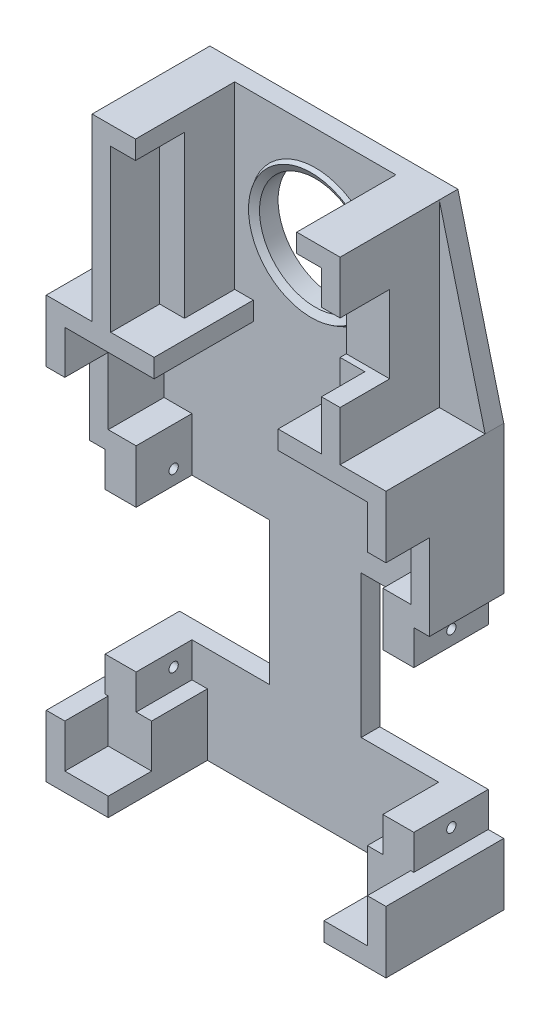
SolidWorks part; units mm, degrees
ref_plane "Plan de face" through (0, 0, 0) normal (0, 0, 1) x (1, 0, 0)
ref_plane "Plan de dessus" through (0, 0, 0) normal (0, 1, 0) x (1, 0, 0)
ref_plane "Plan de droite" through (0, 0, 0) normal (1, 0, 0) x (0, 0, -1)
sketch "Esquisse1" plane through (0, 0, 0) normal (0, 0, 1) x (1, 0, 0)
  line L0 (-27.4, 0) -> (27.4, 0)
  line L1 (27.4, 0) -> (27.4, 10)
  line L2 (27.4, 10) -> (24.9, 10)
  line L3 (24.9, 10) -> (24.9, 15.6)
  line L4 (24.9, 15.6) -> (7.4, 15.6)
  line L5 (7.4, 15.6) -> (7.4, 38.6)
  line L6 (7.4, 38.6) -> (24.9, 38.6)
  line L7 (24.9, 38.6) -> (24.9, 44.2)
  line L8 (24.9, 44.2) -> (27.4, 44.2)
  line L9 (27.4, 44.2) -> (27.4, 68)
  line L10 (27.4, 68) -> (20, 97)
  line L11 (20, 97) -> (-20, 97)
  line L12 (-20, 97) -> (-27.4, 68)
  line L13 (-27.4, 68) -> (-27.4, 44.2)
  line L14 (-27.4, 44.2) -> (-24.9, 44.2)
  line L15 (-24.9, 44.2) -> (-24.9, 38.6)
  line L16 (-24.9, 38.6) -> (-7.4, 38.6)
  line L17 (-7.4, 38.6) -> (-7.4, 15.6)
  line L18 (-7.4, 15.6) -> (-24.9, 15.6)
  line L19 (-24.9, 15.6) -> (-24.9, 10)
  line L20 (-24.9, 10) -> (-27.4, 10)
  line L21 (-27.4, 10) -> (-27.4, 0)
  circle A0 centre (0, 81) radius 9
  dimension "D24" = 18
  dimension "D1" = 97
  dimension "D2" = 23
  dimension "D3" = 23
  dimension "D4" = 17.5
  dimension "D5" = 17.5
  dimension "D6" = 27.4
  dimension "D7" = 27.4
  dimension "D8" = 10
  dimension "D9" = 10
  dimension "D10" = 5.6
  dimension "D11" = 5.6
  dimension "D12" = 5.6
  dimension "D13" = 5.6
  dimension "D14" = 2.5
  dimension "D15" = 2.5
  dimension "D16" = 2.5
  dimension "D17" = 2.5
  dimension "D18" = 17.5
  dimension "D19" = 17.5
  dimension "D20" = 68
  dimension "D21" = 68
  dimension "D22" = 7.4
  dimension "D23" = 7.4
  dimension "D25" = 16
extrude "Boss.-Extru.1" add sketch "Esquisse1" along normal blind 3
sketch "Esquisse2" plane through (0, 0, 3) normal (0, 0, 1) x (1, 0, 0)
  line L0 (27.4, 0) -> (27.4, 10) construction
  line L1 (-27.4, 68) -> (-20, 68)
  line L2 (-27.4, 68) -> (-27.4, 44.2)
  line L3 (-24.4, 58) -> (-17.4, 58)
  line L4 (-17.4, 65) -> (-17.4, 58)
  line L5 (27.4, 68) -> (20, 68)
  line L6 (27.4, 68) -> (27.4, 44.2)
  line L7 (24.4, 58) -> (17.4, 58)
  line L8 (17.4, 65) -> (17.4, 58)
  line L9 (-27.4, 0) -> (-17.4, 0)
  line L10 (-27.4, 0) -> (-27.4, 10)
  line L11 (-27.4, 10) -> (-24.9, 10)
  line L12 (-17.4, 0) -> (-17.4, 10)
  line L13 (27.4, 0) -> (17.4, 0)
  line L14 (27.4, 0) -> (27.4, 10)
  line L15 (27.4, 10) -> (24.9, 10)
  line L16 (17.4, 0) -> (17.4, 10)
  line L17 (-27.4, 0) -> (27.4, 0) construction
  line L18 (24.9, 15.6) -> (7.4, 15.6) construction
  line L19 (-24.9, 15.6) -> (-19.9, 15.6)
  line L20 (-24.9, 15.6) -> (-24.9, 10)
  line L22 (-19.9, 15.6) -> (-19.9, 10)
  line L23 (24.9, 15.6) -> (19.9, 15.6)
  line L24 (24.9, 15.6) -> (24.9, 10)
  line L26 (19.9, 15.6) -> (19.9, 10)
  line L27 (-19.9, 10) -> (-17.4, 10)
  line L28 (19.9, 10) -> (17.4, 10)
  line L29 (20, 97) -> (-20, 97) construction
  line L30 (-24.9, 38.6) -> (-19.9, 38.6)
  line L31 (-24.9, 38.6) -> (-24.9, 44.2)
  line L33 (-19.9, 38.6) -> (-19.9, 47.2)
  line L34 (24.9, 38.6) -> (19.9, 38.6)
  line L35 (24.9, 38.6) -> (24.9, 44.2)
  line L36 (24.4, 47.2) -> (19.9, 47.2)
  line L37 (19.9, 38.6) -> (19.9, 47.2)
  line L38 (-17.4, 65) -> (-13, 65)
  line L39 (-20, 68) -> (-20, 97)
  line L40 (-20, 97) -> (-13, 97)
  line L41 (-13, 65) -> (-13, 97)
  line L42 (-20, 97) -> (-27.4, 68) construction
  line L43 (17.4, 65) -> (13, 65)
  line L44 (20, 68) -> (20, 97)
  line L45 (20, 97) -> (13, 97)
  line L46 (13, 65) -> (13, 97)
  line L47 (27.4, 68) -> (20, 97) construction
  line L49 (-24.4, 58) -> (-24.4, 47.2)
  line L50 (-24.9, 44.2) -> (-27.4, 44.2)
  line L51 (-24.4, 47.2) -> (-19.9, 47.2)
  line L52 (24.4, 58) -> (24.4, 47.2)
  line L53 (24.9, 44.2) -> (27.4, 44.2) construction
  line L54 (-27.4, 68) -> (-27.4, 44.2) construction
  line L55 (24.9, 44.2) -> (27.4, 44.2)
  point P2 (27.4, 44.8457)
  point P7 (23.7, 68)
  dimension "D1" = 10
  dimension "D2" = 10
  dimension "D3" = 10
  dimension "D4" = 10
  dimension "D5" = 3
  dimension "D6" = 3
  dimension "D7" = 3
  dimension "D8" = 10
  dimension "D9" = 5
  dimension "D10" = 5
  dimension "D11" = 5
  dimension "D12" = 5
  dimension "D13" = 7
  dimension "D14" = 7
  dimension "D15" = 10
  dimension "D16" = 3
  dimension "D17" = 3
  dimension "D18" = 3
  dimension "D19" = 10
  dimension "D20" = 10
extrude "Boss.-Extru.2" add sketch "Esquisse2" along normal blind 9
sketch "Esquisse3" plane through (0, 0, 3) normal (0, 0, 1) x (1, 0, 0)
  line L0 (-27.4, 0) -> (-27.4, 10)
  line L1 (-27.4, 10) -> (-24.4, 10)
  line L2 (-24.4, 10) -> (-24.4, 3)
  line L3 (-24.4, 3) -> (-17.4, 3)
  line L4 (-17.4, 0) -> (-17.4, 10) construction
  line L5 (-17.4, 3) -> (-17.4, 0)
  line L6 (-27.4, 0) -> (-17.4, 0) construction
  line L7 (-17.4, 0) -> (-27.4, 0)
  line L8 (27.4, 0) -> (27.4, 10)
  line L9 (27.4, 10) -> (24.4, 10)
  line L10 (24.4, 10) -> (24.4, 3)
  line L11 (24.4, 3) -> (17.4, 3)
  line L12 (17.4, 10) -> (17.4, 0) construction
  line L13 (17.4, 3) -> (17.4, 0)
  line L14 (17.4, 0) -> (27.4, 0)
  line L15 (-27.4, 68) -> (-20, 68)
  line L16 (-20, 68) -> (-20, 97)
  line L18 (20, 88.5) -> (20, 97)
  line L19 (-17, 94) -> (-17, 68)
  line L20 (-17, 68) -> (-10, 68)
  line L21 (17, 88.5) -> (20, 88.5)
  line L22 (-10, 68) -> (-10, 65)
  line L23 (-10, 65) -> (-24.4, 65)
  line L24 (-24.4, 65) -> (-24.4, 58)
  line L25 (-24.4, 58) -> (-17.4, 58) construction
  line L26 (-24.4, 58) -> (-27.4, 58)
  line L27 (-27.4, 58) -> (-27.4, 44.2) construction
  line L28 (-27.4, 58) -> (-27.4, 68)
  line L29 (24.4, 58) -> (27.4, 58)
  line L30 (17.4, 58) -> (24.4, 58) construction
  line L31 (27.4, 58) -> (27.4, 68)
  line L32 (27.4, 68) -> (20, 68)
  line L33 (20, 68) -> (20, 97) construction
  line L34 (20, 68) -> (20, 97) construction
  line L35 (20, 68) -> (20, 76)
  line L38 (17, 94) -> (17, 88.5)
  line L39 (17, 68) -> (10, 68)
  line L40 (10, 68) -> (10, 65)
  line L41 (10, 65) -> (24.4, 65)
  line L42 (24.4, 65) -> (24.4, 58)
  line L44 (17, 76) -> (20, 76)
  line L46 (17, 76) -> (17, 68)
  line L47 (-20, 97) -> (-13, 97)
  line L48 (-13, 97) -> (-13, 94)
  line L49 (-13, 65) -> (-13, 97) construction
  line L50 (-13, 94) -> (-17, 94)
  line L51 (20, 97) -> (13, 97)
  line L52 (13, 97) -> (13, 94)
  line L53 (13, 97) -> (13, 65) construction
  line L54 (13, 94) -> (17, 94)
  dimension "D1" = 3
  dimension "D2" = 3
  dimension "D3" = 3
  dimension "D4" = 3
  dimension "D5" = 3
  dimension "D6" = 3
  dimension "D7" = 3
  dimension "D8" = 3
  dimension "D9" = 3
  dimension "D10" = 3
  dimension "D11" = 3
  dimension "D12" = 3
  dimension "D13" = 5.5
  dimension "D14" = 8
  dimension "D15" = 3
  dimension "D16" = 3
  dimension "D17" = 7
  dimension "D18" = 7
extrude "Boss.-Extru.3" add sketch "Esquisse3" along normal blind 16
sketch "Esquisse4" plane through (0, 0, 0) normal (1, 0, 0) x (0, 0, -1)
  line L0 (-3, 72) -> (-3.6495, 70.875)
  line L1 (-3.6495, 70.875) -> (-3, 70.5)
  line L2 (-3, 68) -> (-3, 97) construction
  line L3 (-3, 70.5) -> (-3, 72)
  line L4 (-8.5738, 81) -> (12.7557, 81) construction
  dimension "D1" = 30
  dimension "D2" = 1.5
  dimension "D3" = 9
revolve "Révolution1" add sketch "Esquisse4" angle 360 about L4
sketch "Esquisse5" plane through (0, 0, 0) normal (1, 0, 0) x (0, 0, -1)
  line L0 (0, 10) -> (0, 15.6) construction
  line L1 (0, 38.6) -> (0, 44.2) construction
  line L2 (-12, 38.6) -> (0, 38.6) construction
  line L3 (-12, 15.6) -> (0, 15.6) construction
  circle A0 centre (-5.95, 40.95) radius 0.75
  circle A1 centre (-5.95, 13.25) radius 0.75
  dimension "D5" = 1.5
  dimension "D6" = 1.5
  dimension "D1" = 5.95
  dimension "D2" = 5.95
  dimension "D3" = 2.35
  dimension "D4" = 2.35
extrude "Enlèv. mat.-Extru.1" cut sketch "Esquisse5" against normal mid plane 110
sketch "Esquisse7" plane through (0, 0, 12) normal (0, 0, 1) x (1, 0, 0)
  line L0 (13, 97) -> (13, 68) construction
  line L1 (20, 88.5) -> (13, 88.5)
  line L2 (20, 88.5) -> (20, 76)
  line L3 (20, 76) -> (13, 76)
  line L4 (13, 88.5) -> (13, 76)
extrude "Enlèv. mat.-Extru.2" cut sketch "Esquisse7" against normal blind 1
sketch "Esquisse9" plane through (0, 0, 12) normal (0, 0, 1) x (1, 0, 0)
  line L1 (-13, 94) -> (-17, 94)
  line L2 (-13, 94) -> (-13, 68)
  line L3 (-13, 68) -> (-17, 68)
  line L4 (-17, 94) -> (-17, 68)
extrude "Enlèv. mat.-Extru.3" cut sketch "Esquisse9" against normal blind 0.9
